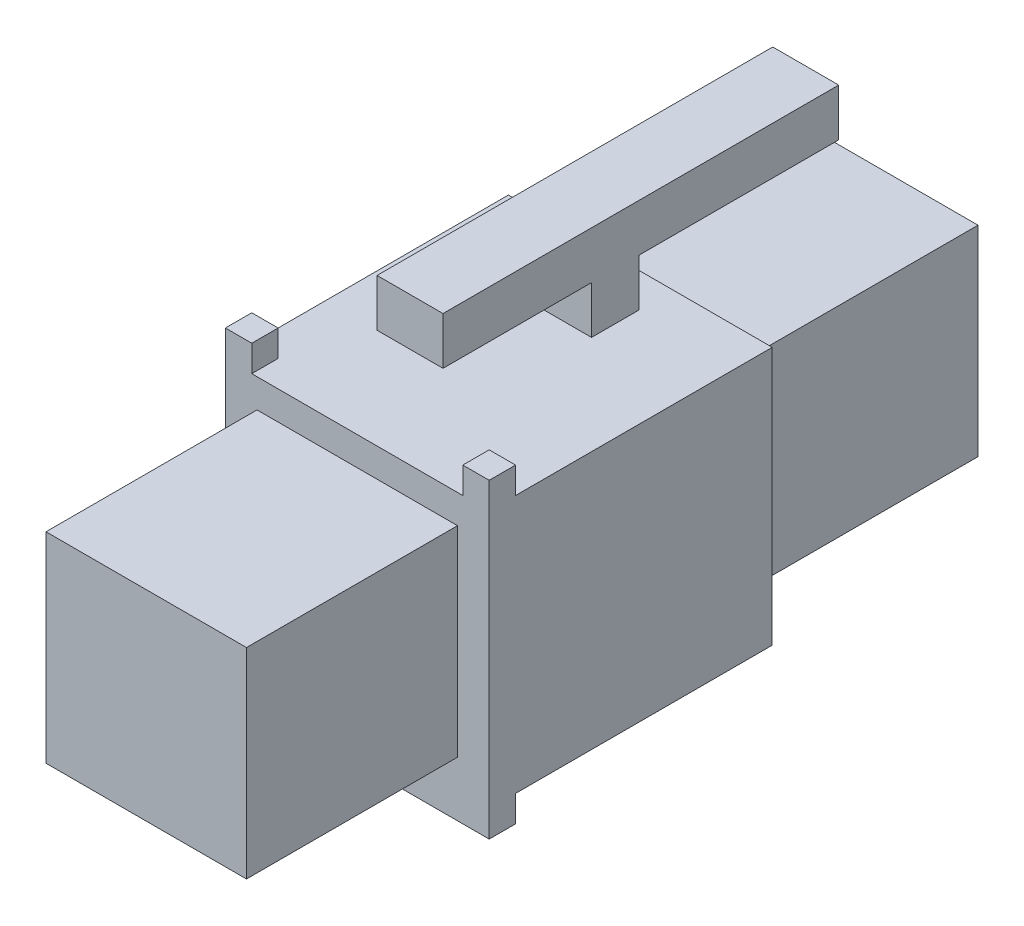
SolidWorks part; units mm, degrees
ref_plane "前基準面" through (0, 0, 0) normal (0, 0, 1) x (1, 0, 0)
ref_plane "上基準面" through (0, 0, 0) normal (0, 1, 0) x (1, 0, 0)
ref_plane "右基準面" through (0, 0, 0) normal (1, 0, 0) x (0, 0, -1)
sketch "草圖1" plane through (0, 0, 0) normal (1, 0, 0) x (0, 0, -1)
  line L0 (0, 71.0129) -> (0, -54.3652) construction
  line L1 (-62.2989, 0) -> (68.0215, 0) construction
  line L2 (-10.73, 4.89) -> (-10.73, -4.89)
  line L3 (-10.73, -4.89) -> (0, -4.89)
  line L4 (-10.73, 4.89) -> (0, 4.89)
  line L5 (-62.2989, -4.89) -> (68.0215, -4.89) construction
  line L6 (-62.2989, 4.89) -> (68.0215, 4.89) construction
  line L7 (-10.73, 71.0129) -> (-10.73, -54.3652) construction
  line L8 (0, 4.89) -> (0, -4.89)
  dimension "D1" = 10.73
  dimension "D2" = 4.89
  dimension "D3" = 4.89
extrude "伸長1" add sketch "草圖1" along normal mid plane 10
sketch "草圖2" plane through (5, 0, 0) normal (1, 0, 0) x (0, 0, -1)
  line L1 (-10.73, 4.89) -> (-9.73, 4.89)
  line L2 (-10.73, 4.89) -> (-10.73, 5.89)
  line L3 (-10.73, 5.89) -> (-9.73, 5.89)
  line L4 (-9.73, 4.89) -> (-9.73, 5.89)
  line L5 (-10.73, -4.89) -> (-9.73, -4.89)
  line L6 (-10.73, -4.89) -> (-10.73, -5.89)
  line L7 (-10.73, -5.89) -> (-9.73, -5.89)
  line L8 (-9.73, -4.89) -> (-9.73, -5.89)
  dimension "D1" = 1
extrude "伸長2" add sketch "草圖2" against normal up to surface (10 mm away)
sketch "草圖3" plane through (0, 0, 0) normal (0, 0, -1) x (-1, 0, 0)
  line L0 (0, 4.89) -> (0, -4.89) construction
  line L1 (-5, 4.89) -> (5, 4.89) construction
  line L2 (-5, -4.89) -> (5, -4.89) construction
  line L3 (0, 0) -> (-5, 0) construction
  line L4 (-5, -4.89) -> (-5, 4.89) construction
  line L5 (-3.8, 3.8) -> (-3.8, -3.8)
  line L6 (3.8, 3.8) -> (-3.8, 3.8)
  line L7 (3.8, 3.8) -> (3.8, -3.8)
  line L8 (3.8, -3.8) -> (-3.8, -3.8)
  line L9 (-3.8, 4.89) -> (-3.8, -4.89) construction
  line L10 (0, 3.8) -> (-5, 3.8) construction
  line L11 (0, -3.8) -> (-5, -3.8) construction
  line L12 (3.8, 4.89) -> (3.8, -4.89) construction
  dimension "D1" = 3.8
  dimension "D2" = 3.8
extrude "伸長3" add sketch "草圖3" along normal blind 9
sketch "草圖4" plane through (0, 0, 0) normal (1, 0, 0) x (0, 0, -1)
  line L0 (0, 4.89) -> (-9.73, 4.89) construction
  line L1 (-8.73, 8.49) -> (6.27, 8.49)
  line L2 (-8.73, 8.49) -> (-8.73, 6.69)
  line L3 (-8.73, 6.69) -> (-3.1, 6.69)
  line L4 (6.27, 8.49) -> (6.27, 6.69)
  line L5 (0, -4.89) -> (0, 4.89) construction
  line L6 (-3.1, 6.69) -> (-3.1, 4.89)
  line L7 (-3.1, 4.89) -> (-1.3, 4.89)
  line L8 (-1.3, 6.69) -> (-1.3, 4.89)
  line L9 (-1.3, 6.69) -> (6.27, 6.69)
  line L10 (-10.73, 5.89) -> (-10.73, -5.89) construction
  dimension "D1" = 1.3
  dimension "D2" = 1.8
  dimension "D3" = 17
  dimension "D4" = 15
  dimension "D5" = 1.8
  dimension "D6" = 3.6
extrude "伸長4" add sketch "草圖4" along normal mid plane 2.5
sketch "草圖5" plane through (0, 4.89, 0) normal (0, 1, 0) x (1, 0, 0)
  line L0 (0, 13.1923) -> (0, -13.9638) construction
  line L1 (-5, -9.73) -> (5, -9.73) construction
  line L2 (-4, -9.73) -> (4, -9.73)
  line L3 (-4, -9.73) -> (-4, -10.73)
  line L4 (-4, -10.73) -> (4, -10.73)
  line L5 (4, -9.73) -> (4, -10.73)
  line L6 (-5, -10.73) -> (5, -10.73) construction
  dimension "D1" = 8
extrude "除料-伸長1" cut sketch "草圖5" along normal through all
sketch "草圖6" plane through (0, 0, 10.73) normal (0, 0, 1) x (1, 0, 0)
  line L4 (3.8, 3.8) -> (-3.8, 3.8)
  line L5 (3.8, -3.8) -> (3.8, 3.8)
  line L6 (-3.8, -3.8) -> (3.8, -3.8)
  line L7 (-3.8, 3.8) -> (-3.8, -3.8)
  line L8 (3.8, 3.8) -> (-3.8, 3.8)
  line L9 (3.8, -3.8) -> (3.8, 3.8)
  line L10 (-3.8, -3.8) -> (3.8, -3.8)
  line L11 (-3.8, 3.8) -> (-3.8, -3.8)
  dimension "D1" = 0
extrude "伸長5" add sketch "草圖6" along normal blind 8
